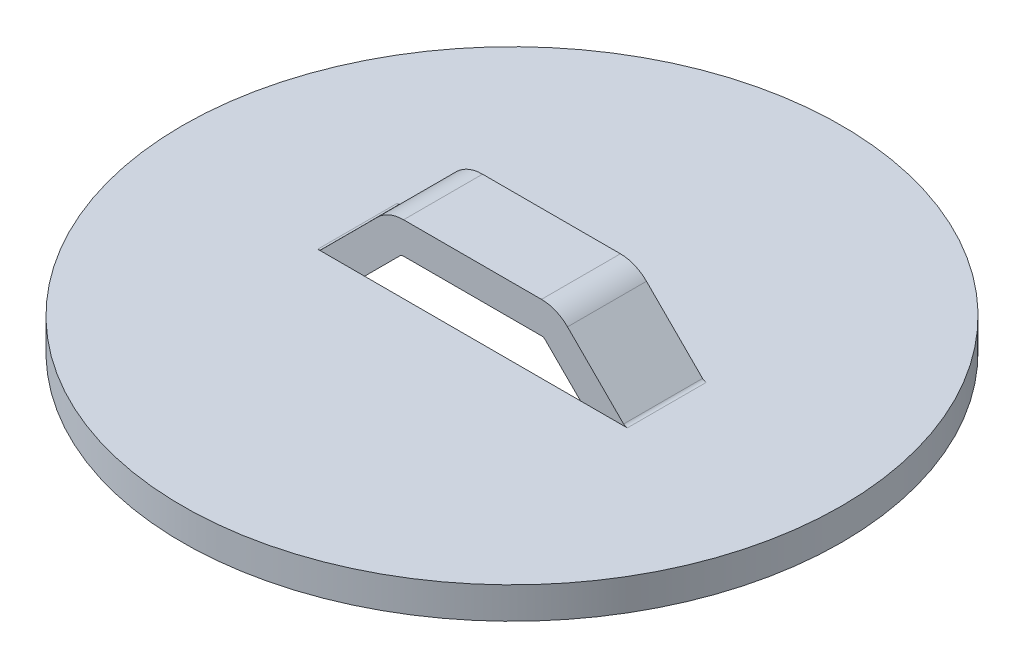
SolidWorks part; units mm, degrees
other "Boss-Extrude1"
ref_plane "Front Plane" through (0, 0, 0) normal (0, 0, 1) x (1, 0, 0)
ref_plane "Top Plane" through (0, 0, 0) normal (0, 1, 0) x (1, 0, 0)
ref_plane "Right Plane" through (0, 0, 0) normal (1, 0, 0) x (0, 0, -1)
imported_body "Imported1"
sketch "Sketch1" plane through (0, -1.524, 0) normal (0, -1, 0) x (1, 0, 0)
  line L0 (0, 0) -> (0, -3.81) construction
  line L1 (-7.4712, 0) -> (7.4712, 0)
  line L2 (-7.4712, 0) -> (-7.4712, -3.81)
  line L3 (-7.4712, -3.81) -> (7.4712, -3.81)
  line L4 (7.4712, 0) -> (7.4712, -3.81)
  circle A0 centre (0, -1.905) radius 15.9058
extrude "Boss-Extrude1" add sketch "Sketch1" against normal up to vertex
other "DeleteFace1"
